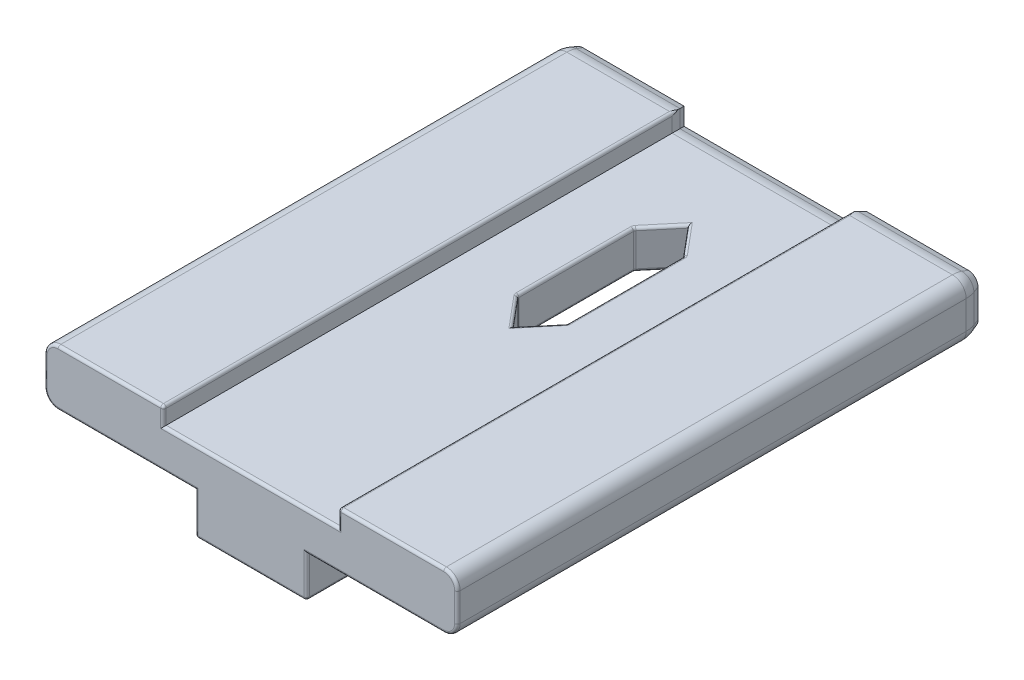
SolidWorks part; units mm, degrees
ref_plane "Front Plane" through (0, 0, 0) normal (0, 0, 1) x (1, 0, 0)
ref_plane "Top Plane" through (0, 0, 0) normal (0, 1, 0) x (1, 0, 0)
ref_plane "Right Plane" through (0, 0, 0) normal (1, 0, 0) x (0, 0, -1)
sketch "Sketch1" plane through (0, 0, 0) normal (0, 0, 1) x (1, 0, 0)
  line L0 (0, 0) -> (10.9614, 0)
  line L1 (10.9614, 0) -> (10.9614, -3)
  line L2 (10.9614, -3) -> (19.0386, -3)
  line L3 (19.0386, -3) -> (19.0386, 0)
  line L4 (19.0386, 0) -> (30, 0)
  line L5 (30, 0) -> (30, 10.75)
  line L6 (30, 10.75) -> (0, 10.75)
  line L7 (0, 10.75) -> (0, 0)
  dimension "D1" = 30
  dimension "D2" = 8.0772
  dimension "D3" = 3
  dimension "D4" = 10.75
extrude "Boss-Extrude1" add sketch "Sketch1" along normal blind 38.1
sketch "Sketch3" plane through (0, 0, 0) normal (0, 0, 1) x (1, 0, 0)
  line L0 (-1.6286, 12.9423) -> (31.7375, 12.9423)
  line L1 (31.7375, 12.9423) -> (31.7375, 4.064)
  line L2 (31.7375, 4.064) -> (21.35, 4.064)
  line L3 (21.35, 4.064) -> (21.35, 2.794)
  line L4 (21.35, 2.794) -> (8.65, 2.794)
  line L5 (8.65, 2.794) -> (8.65, 4.064)
  line L6 (8.65, 4.064) -> (-1.6286, 4.064)
  line L7 (-1.6286, 4.064) -> (-1.6286, 12.9423)
  line L8 (10.9614, -3) -> (19.0386, -3) construction
  line L9 (19.0386, 0) -> (30, 0) construction
  point P10 (15, -3)
  point P11 (15, 2.794)
  dimension "D1" = 12.7
  dimension "D2" = 2.794
  dimension "D3" = 1.27
extrude "Cut-Extrude1" cut sketch "Sketch3" along normal blind 50.8
sketch "Sketch4" plane through (0, 2.794, 0) normal (0, 1, 0) x (1, 0, 0)
  line L0 (15, -40.0604) -> (15, 1.137) construction
  line L1 (21.35, -38.1) -> (8.65, -38.1) construction
  line L2 (13.222, -8.4689) -> (15, -6.35)
  line L3 (15, -6.35) -> (16.778, -8.4689)
  line L4 (16.778, -8.4689) -> (16.778, -16.9311)
  line L5 (16.778, -16.9311) -> (15, -19.05)
  line L6 (15, -19.05) -> (13.222, -16.9311)
  line L7 (13.222, -16.9311) -> (13.222, -8.4689)
  line L9 (8.65, 0) -> (21.35, 0) construction
  circle A0 centre (15, -12.7) radius 1.4972 construction
  point P4 (15, -38.1)
  dimension "D1" = 80
  dimension "D2" = 80
  dimension "D3" = 3.556
  dimension "D4" = 12.7
  dimension "D5" = 6.35
  dimension "D6" = 6.35
extrude "Cut-Extrude2" cut sketch "Sketch4" against normal through all both and the other way through all
sketch "Sketch5" plane through (0, 0, 0) normal (1, 0, 0) x (0, 0, -1)
  line L0 (-22.86, 0) -> (-2.54, 0)
  line L1 (-38.1, 0) -> (0, 0) construction
  line L2 (-2.54, 0) -> (-2.54, -3)
  line L3 (-2.54, -3) -> (-26.4353, -3)
  line L4 (-26.4353, -3) -> (-22.86, 0)
  line L5 (-19.05, -3) -> (-19.05, 2.794) construction
  line L6 (-6.35, -3) -> (-6.35, 2.794) construction
  line L12 (-38.1, -3) -> (0, -3) construction
  point P16 (-34.7497, 0)
  point P17 (-34.8103, 0)
  dimension "D3" = 3.81
  dimension "D4" = 3.81
extrude "Cut-Extrude4" cut sketch "Sketch5" against normal through all and the other way through all
fillet "Fillet2" radius 1 4 edges at (30, 4.064, 19.05) (0, 0, 19.05) (0, 4.064, 19.05) (30, 0, 19.05)
chamfer "Chamfer1" distance 0.8 angle 20 16 edges at (24.0193, 0, 0) (29.7071, 0.2929, 0) (30, 2.032, 0) (0, 2.032, 0) (0.2929, 0.2929, 0) (5.9807, 0, 0) (10.9614, -1.5, 0) (15, -3, 0) (19.0386, -1.5, 0) (21.35, 3.429, 0) (15, 2.794, 0) (8.65, 3.429, 0) (4.825, 4.064, 0) (0.2929, 3.7711, 0) (29.7071, 3.7711, 0) (25.175, 4.064, 0)
fillet "Fillet4" radius 2 16 edges at (24.0193, 0, 0.8) (29.7071, 0.2929, 0.8) (30, 2.032, 0.8) (29.7071, 3.7711, 0.8) (4.825, 4.064, 0.8) (0.2929, 3.7711, 0.8) (0, 2.032, 0.8) (0.2929, 0.2929, 0.8) (21.35, 3.429, 0.8) (8.65, 3.429, 0.8) (15, -3, 0.8) (19.0386, -1.5, 0.8) (25.175, 4.064, 0.8) (15, 2.794, 0.8) (5.9807, 0, 0.8) (10.9614, -1.5, 0.8)
fillet "Fillet5" radius 0.2 14 edges at (10.9614, -1.5, 2.54) (19.0386, -1.5, 2.54) (15, -3, 2.54) (15, 0, 2.54) (19.0386, -3, 32.2676) (10.9614, -3, 32.2676) (10.9614, -3, 1.8463) (19.0386, -3, 1.8463) (10.9614, -1.5, 24.6476) (19.0386, -1.5, 24.6476) (15, -3, 26.4353) (15, 0, 22.86) (8.65, 4.064, 19.6263) (21.35, 4.064, 19.6263)
fillet "Fillet6" radius 0.2 36 edges at (16.778, 2.794, 12.7) (14.111, 2.794, 7.4095) (29.7071, 0.2929, 38.1) (5.9807, 0, 38.1) (24.0193, 0, 38.1) (0.2929, 0.2929, 38.1) (0, 2.032, 38.1) (0.2929, 3.7711, 38.1) (4.725, 4.064, 38.1) (8.65, 3.329, 38.1) (15, 2.794, 38.1) (21.35, 3.329, 38.1) (25.275, 4.064, 38.1) (29.7071, 3.7711, 38.1) (30, 2.032, 38.1) (15.889, 2.794, 7.4095) (16.778, 1.397, 8.4689) (16.778, 1.397, 16.9311) (15.889, 2.794, 17.9905) (13.222, 1.397, 8.4689) (13.222, 1.397, 16.9311) (13.222, 2.794, 12.7) (14.111, 2.794, 17.9905) (14.111, 0, 17.9905) (13.222, 0, 12.7) (14.111, 0, 7.4095) (15.889, 0, 7.4095) (16.778, 0, 12.7) (15.889, 0, 17.9905) (21.4086, 4.0054, 38.1) (8.5914, 4.0054, 38.1) (19.0386, -1.4, 38.1) (18.98, -2.9414, 38.1) (15, -3, 38.1) (11.02, -2.9414, 38.1) (10.9614, -1.4, 38.1)
